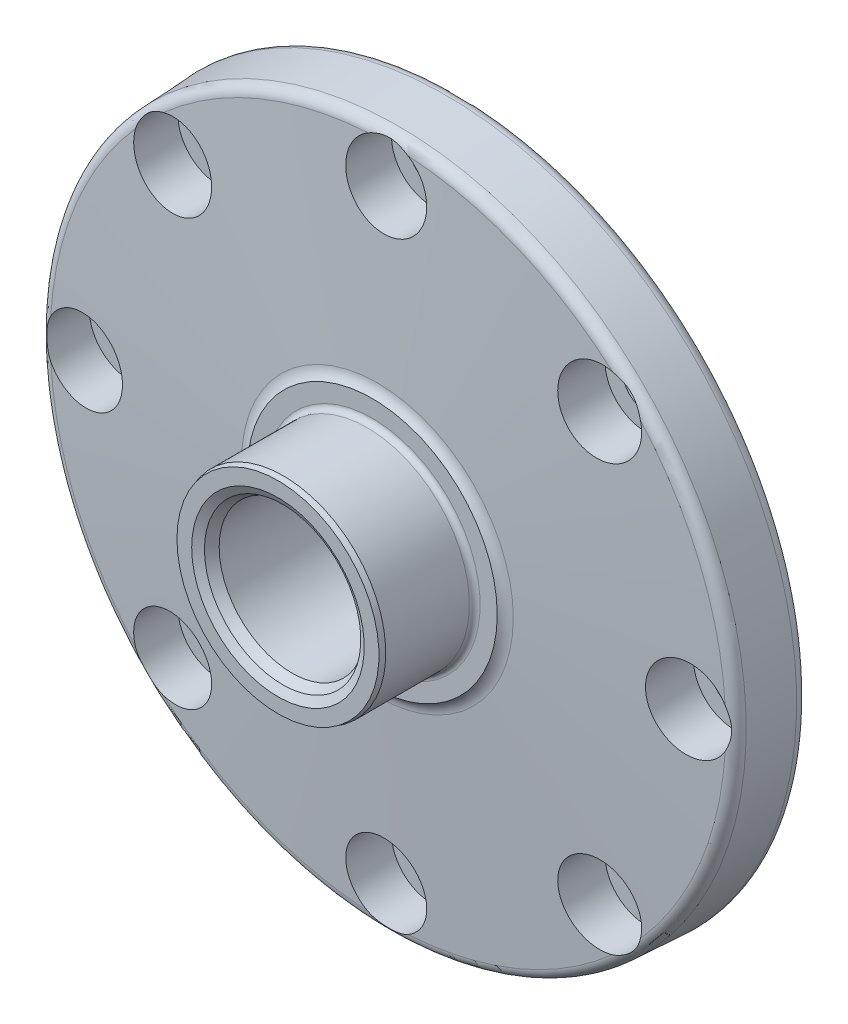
SolidWorks part; units mm, degrees
ref_plane "Plan de face" through (0, 0, 0) normal (0, 0, 1) x (1, 0, 0)
ref_plane "Plan de dessus" through (0, 0, 0) normal (0, 1, 0) x (1, 0, 0)
ref_plane "Plan de droite" through (0, 0, 0) normal (1, 0, 0) x (0, 0, -1)
sketch "Esquisse1" plane through (0, 0, 0) normal (1, 0, 0) x (0, 0, -1)
  line L0 (0, 0) -> (-55.1375, 0) construction
  line L1 (-16.0037, 64.5336) -> (-7.1047, 65)
  line L2 (0, 0) -> (0, 69.4206) construction
  line L3 (-38.1047, 21.5512) -> (-22.6975, 22.3586)
  line L4 (-2.157, 51) -> (1.1047, 50.8291)
  line L5 (-5, 53.9959) -> (-5, 63.0027)
  line L7 (-17.8963, 62.641) -> (-19.8586, 25.1975)
  line L8 (3, 35) -> (-9.157, 34.3629)
  line L11 (-40, 19.5539) -> (-40, 11)
  line L19 (3, 48.8318) -> (3, 35)
  line L23 (-12, 31.367) -> (-12, 14.3653)
  line L24 (-13.8953, 12.3681) -> (-40, 11)
  arc A0 (1.1047, 50.8291) -> (3, 48.8318) centre (1, 48.8318) cw
  arc A1 (-2.157, 51) -> (-5, 53.9959) centre (-2, 53.9959) cw
  arc A2 (-16.0037, 64.5336) -> (-17.8963, 62.641) centre (-15.899, 62.5364) ccw
  arc A3 (-12, 31.367) -> (-9.157, 34.3629) centre (-9, 31.367) cw
  arc A4 (-5, 63.0027) -> (-7.1047, 65) centre (-7, 63.0027) ccw
  arc A5 (-22.6975, 22.3586) -> (-19.8586, 25.1975) centre (-22.8545, 25.3545) ccw
  arc A6 (-12, 14.3653) -> (-13.8953, 12.3681) centre (-14, 14.3653) cw
  arc A7 (-38.1047, 21.5512) -> (-40, 19.5539) centre (-38, 19.5539) ccw
  point P23 (-20, 22.5)
  dimension "D6" = 70
  dimension "D1" = 2
  dimension "D2" = 3
  dimension "D3" = 3
  dimension "D4" = 3
  dimension "D5" = 130
  dimension "D7" = 22
  dimension "D8" = 102
  dimension "D9" = 43
  dimension "D10" = 12
  dimension "D11" = 3
  dimension "D13" = 20
  dimension "D14" = 45
  dimension "D15" = 5
revolve "Brut-Révolution-1" add sketch "Esquisse1" angle 360 about L0
sketch "Esquisse12" plane through (0, 0, 0) normal (1, 0, 0) x (0, 0, -1)
  line L0 (0, 65.0027) -> (0, 79.0399) construction
  line L1 (0, 0) -> (-48.9974, 0) construction
  line L2 (0, 42.5) -> (0, 49.4656)
  line L3 (-1.5, 65.0027) -> (-20.8, 65.0027)
  line L4 (-38.3, 0) -> (-52.3372, 0)
  line L5 (-52.3372, 0) -> (-52.3372, 79.0399)
  line L6 (-52.3372, 79.0399) -> (17.0372, 79.0399)
  line L7 (17.0372, 79.0399) -> (17.0372, 0)
  line L8 (-20.8, 65.0027) -> (-20.8, 20)
  line L9 (-21.8, 19) -> (-38.3, 19)
  line L10 (-38.3, 19) -> (-38.3, 0)
  line L11 (17.0372, 0) -> (3, 0)
  line L12 (-1.5, 65.0027) -> (-1.5, 50.9656)
  line L13 (-1.5, 50.9656) -> (0, 49.4656)
  line L14 (0, 79.0399) -> (0, 49.4656) construction
  line L15 (-1.5, 65.0027) -> (0, 65.0027) construction
  line L16 (1.1047, 50.8291) -> (-2.157, 51) construction
  line L18 (3, 0) -> (3, 42)
  line L19 (3, 42) -> (0.5, 42)
  arc A0 (-5, 63.0027) -> (-7.1047, 65) centre (-7, 63.0027) ccw construction
  arc A3 (-20.8, 20) -> (-21.8, 19) centre (-21.8, 20) cw
  arc A5 (0, 42.5) -> (0.5, 42) centre (0.5, 42.5) ccw
  dimension "D17" = 1
  dimension "D20" = 0.5
  dimension "D1" = 38.3
  dimension "D2" = 20.8
  dimension "D3" = 3
  dimension "D4" = 45
  dimension "D5" = 1.5
  dimension "D9" = 38
  dimension "D12" = 84
revolve "Chariotage" cut sketch "Esquisse12" angle 360 about L1
chamfer "Chanfrein1" distance 1 angle 15 1 edges at (-19, 0, 38.3)
chamfer "Chanfrein2" distance 1 angle 15 1 edges at (-42, 0, -3)
sketch "Esquisse13" plane through (0, 0, 0) normal (1, 0, 0) x (0, 0, -1)
  line L0 (-38.3, 0) -> (3, 0)
  line L1 (0, 0) -> (-49.0722, 0) construction
  line L2 (3, -42) -> (3, 42) construction
  line L3 (-38.3, 19) -> (-38.3, -19) construction
  line L4 (3, 0) -> (3, 37.1)
  line L5 (-38.3, 16) -> (-38.3, 0)
  line L6 (-35.7019, 13.5) -> (-14.5, 13.5)
  line L7 (-14.5, 13.5) -> (-14.5, 21)
  line L8 (-14.5, 21) -> (-13.3, 21)
  line L9 (-13.3, 21) -> (-13.3, 40.5)
  line L10 (-13.3, 40.5) -> (-12.3, 40.5)
  line L11 (-12.3, 40.5) -> (-12.3, 37.1)
  line L12 (-12.3, 37.1) -> (3, 37.1)
  line L13 (0, -49.4656) -> (0, 49.4656) construction
  line L15 (-38.3, 16) -> (-37.434, 14.5)
  line L16 (-37.434, 14.5) -> (-35.7019, 13.5)
  dimension "D2" = 14.5
  dimension "D3" = 13.3
  dimension "D4" = 12.3
  dimension "D7" = 60
  dimension "D8" = 30
  dimension "D11" = 74.2
  dimension "D12" = 42
  dimension "D13" = 81
  dimension "D14" = 27
  dimension "D17" = 32
  dimension "D18" = 29
revolve "Alésage" cut sketch "Esquisse13" angle 360 about L1
sketch "Esquisse14" plane through (0, 0, 0) normal (0, 0, 1) x (1, 0, 0)
  line L0 (-0.3281, 37.5986) -> (0, 0) construction
  line L1 (0, 0) -> (0.3281, 37.5986) construction
  line L2 (0.3281, 37.5986) -> (-0.3281, 37.5986) construction
  line L3 (0, 0) -> (0, 40.1) construction
  line L4 (0, 0) -> (7.8231, 39.3295) construction
  line L5 (0, 0) -> (15.3456, 37.0476) construction
  line L6 (0, 0) -> (22.2784, 33.3419) construction
  line L7 (0, 0) -> (28.355, 28.355) construction
  line L8 (0, 0) -> (40.1, 0) construction
  line L9 (0, 0) -> (39.3295, -7.8231) construction
  line L10 (0, 0) -> (37.0476, -15.3456) construction
  line L11 (0, 0) -> (33.3419, -22.2784) construction
  line L12 (0, 0) -> (28.355, -28.355) construction
  line L13 (0, 0) -> (0, -40.1) construction
  line L14 (0, 0) -> (-7.8231, -39.3295) construction
  line L15 (0, 0) -> (-15.3456, -37.0476) construction
  line L16 (0, 0) -> (-22.2784, -33.3419) construction
  line L17 (0, 0) -> (-28.355, -28.355) construction
  line L18 (0, 0) -> (-40.1, 0) construction
  line L19 (0, 0) -> (-39.3295, 7.8231) construction
  line L20 (0, 0) -> (-37.0476, 15.3456) construction
  line L21 (0, 0) -> (-33.3419, 22.2784) construction
  line L22 (0, 0) -> (-28.355, 28.355) construction
  arc A0 (-3.0109, 37.4793) -> (-24.3728, 28.6309) centre (0, 0) ccw
  arc A1 (0.3499, 40.0985) -> (-0.3499, 40.0985) centre (0, 0) ccw
  arc A2 (-0.3499, 40.0985) -> (-2.827, 37.6727) centre (-0.3281, 37.5986) ccw
  arc A3 (2.827, 37.6727) -> (0.3499, 40.0985) centre (0.3281, 37.5986) ccw
  arc A4 (10.1223, 36.3973) -> (8.166, 39.2597) centre (7.6569, 36.8121) ccw
  arc A5 (7.4796, 39.3963) -> (4.5769, 37.5003) centre (7.0133, 36.9401) ccw
  arc A6 (17.0285, 33.7232) -> (15.6683, 36.9122) centre (14.6915, 34.611) ccw
  arc A7 (15.0217, 37.1801) -> (11.8049, 35.8869) centre (14.0852, 34.8621) ccw
  arc A8 (23.2804, 29.7531) -> (22.5685, 33.1462) centre (21.1615, 31.0798) ccw
  arc A9 (21.9866, 33.5351) -> (18.5792, 32.8943) centre (20.6158, 31.4444) ccw
  arc A10 (28.6376, 24.6396) -> (28.6013, 28.1065) centre (26.8182, 26.3542) ccw
  arc A11 (28.1065, 28.6013) -> (24.6396, 28.6376) centre (26.3542, 26.8182) ccw
  arc A12 (8.166, 39.2597) -> (7.4796, 39.3963) centre (0, 0) ccw
  arc A13 (15.6683, 36.9122) -> (15.0217, 37.1801) centre (0, 0) ccw
  arc A14 (22.5685, 33.1462) -> (21.9866, 33.5351) centre (0, 0) ccw
  arc A15 (4.3588, 37.3465) -> (3.0109, 37.4793) centre (0, 0) ccw
  arc A16 (11.561, 35.7785) -> (10.2649, 36.1717) centre (0, 0) ccw
  arc A17 (18.3189, 32.8356) -> (17.1244, 33.4741) centre (0, 0) ccw
  arc A18 (24.3728, 28.6309) -> (23.3258, 29.4901) centre (0, 0) ccw
  arc A19 (-2.827, 37.6727) -> (-3.0109, 37.4793) centre (-3.0269, 37.6786) cw
  arc A20 (2.827, 37.6727) -> (3.0109, 37.4793) centre (3.0269, 37.6786) ccw
  arc A21 (4.5769, 37.5003) -> (4.3588, 37.3465) centre (4.382, 37.5452) cw
  arc A22 (10.1223, 36.3973) -> (10.2649, 36.1717) centre (10.3195, 36.3641) ccw
  arc A23 (11.8049, 35.8869) -> (11.561, 35.7785) centre (11.6225, 35.9689) cw
  arc A24 (17.0285, 33.7232) -> (17.1244, 33.4741) centre (17.2155, 33.6521) ccw
  arc A25 (18.5792, 32.8943) -> (18.3189, 32.8356) centre (18.4163, 33.0103) cw
  arc A26 (23.2804, 29.7531) -> (23.3258, 29.4901) centre (23.4499, 29.6469) ccw
  arc A27 (24.6396, 28.6376) -> (24.3728, 28.6309) centre (24.5024, 28.7832) cw
  arc A28 (28.6376, 24.6396) -> (28.6309, 24.3728) centre (28.7832, 24.5024) ccw
  arc A29 (40.0985, -0.3499) -> (40.0985, 0.3499) centre (0, 0) ccw
  arc A30 (40.0985, 0.3499) -> (37.6727, 2.827) centre (37.5986, 0.3281) ccw
  arc A31 (37.6727, -2.827) -> (40.0985, -0.3499) centre (37.5986, -0.3281) ccw
  arc A32 (36.3973, -10.1223) -> (39.2597, -8.166) centre (36.8121, -7.6569) ccw
  arc A33 (39.3963, -7.4796) -> (37.5003, -4.5769) centre (36.9401, -7.0133) ccw
  arc A34 (33.7232, -17.0285) -> (36.9122, -15.6683) centre (34.611, -14.6915) ccw
  arc A35 (37.1801, -15.0217) -> (35.8869, -11.8049) centre (34.8621, -14.0852) ccw
  arc A36 (29.7531, -23.2804) -> (33.1462, -22.5685) centre (31.0798, -21.1615) ccw
  arc A37 (33.5351, -21.9866) -> (32.8943, -18.5792) centre (31.4444, -20.6158) ccw
  arc A38 (24.6396, -28.6376) -> (28.1065, -28.6013) centre (26.3542, -26.8182) ccw
  arc A39 (28.6013, -28.1065) -> (28.6376, -24.6396) centre (26.8182, -26.3542) ccw
  arc A40 (39.2597, -8.166) -> (39.3963, -7.4796) centre (0, 0) ccw
  arc A41 (36.9122, -15.6683) -> (37.1801, -15.0217) centre (0, 0) ccw
  arc A42 (33.1462, -22.5685) -> (33.5351, -21.9866) centre (0, 0) ccw
  arc A43 (37.3465, -4.3588) -> (37.4793, -3.0109) centre (0, 0) ccw
  arc A44 (35.7785, -11.561) -> (36.1717, -10.2649) centre (0, 0) ccw
  arc A45 (32.8356, -18.3189) -> (33.4741, -17.1244) centre (0, 0) ccw
  arc A46 (28.6309, -24.3728) -> (29.4901, -23.3258) centre (0, 0) ccw
  arc A47 (37.6727, -2.827) -> (37.4793, -3.0109) centre (37.6786, -3.0269) ccw
  arc A48 (37.5003, -4.5769) -> (37.3465, -4.3588) centre (37.5452, -4.382) cw
  arc A49 (36.3973, -10.1223) -> (36.1717, -10.2649) centre (36.3641, -10.3195) ccw
  arc A50 (35.8869, -11.8049) -> (35.7785, -11.561) centre (35.9689, -11.6225) cw
  arc A51 (33.7232, -17.0285) -> (33.4741, -17.1244) centre (33.6521, -17.2155) ccw
  arc A52 (32.8943, -18.5792) -> (32.8356, -18.3189) centre (33.0103, -18.4163) cw
  arc A53 (29.7531, -23.2804) -> (29.4901, -23.3258) centre (29.6469, -23.4499) ccw
  arc A54 (28.6376, -24.6396) -> (28.6309, -24.3728) centre (28.7832, -24.5024) cw
  arc A55 (24.6396, -28.6376) -> (24.3728, -28.6309) centre (24.5024, -28.7832) ccw
  arc A56 (28.1065, -28.6013) -> (28.6013, -28.1065) centre (0, 0) ccw
  arc A57 (-0.3499, -40.0985) -> (0.3499, -40.0985) centre (0, 0) ccw
  arc A58 (0.3499, -40.0985) -> (2.827, -37.6727) centre (0.3281, -37.5986) ccw
  arc A59 (-2.827, -37.6727) -> (-0.3499, -40.0985) centre (-0.3281, -37.5986) ccw
  arc A60 (-10.1223, -36.3973) -> (-8.166, -39.2597) centre (-7.6569, -36.8121) ccw
  arc A61 (-7.4796, -39.3963) -> (-4.5769, -37.5003) centre (-7.0133, -36.9401) ccw
  arc A62 (-17.0285, -33.7232) -> (-15.6683, -36.9122) centre (-14.6915, -34.611) ccw
  arc A63 (-15.0217, -37.1801) -> (-11.8049, -35.8869) centre (-14.0852, -34.8621) ccw
  arc A64 (-23.2804, -29.7531) -> (-22.5685, -33.1462) centre (-21.1615, -31.0798) ccw
  arc A65 (-21.9866, -33.5351) -> (-18.5792, -32.8943) centre (-20.6158, -31.4444) ccw
  arc A66 (-28.6376, -24.6396) -> (-28.6013, -28.1065) centre (-26.8182, -26.3542) ccw
  arc A67 (-28.1065, -28.6013) -> (-24.6396, -28.6376) centre (-26.3542, -26.8182) ccw
  arc A68 (-8.166, -39.2597) -> (-7.4796, -39.3963) centre (0, 0) ccw
  arc A69 (-15.6683, -36.9122) -> (-15.0217, -37.1801) centre (0, 0) ccw
  arc A70 (-22.5685, -33.1462) -> (-21.9866, -33.5351) centre (0, 0) ccw
  arc A71 (-4.3588, -37.3465) -> (-3.0109, -37.4793) centre (0, 0) ccw
  arc A72 (-11.561, -35.7785) -> (-10.2649, -36.1717) centre (0, 0) ccw
  arc A73 (-18.3189, -32.8356) -> (-17.1244, -33.4741) centre (0, 0) ccw
  arc A74 (28.6013, 28.1065) -> (28.1065, 28.6013) centre (0, 0) ccw
  arc A75 (-24.3728, -28.6309) -> (-23.3258, -29.4901) centre (0, 0) ccw
  arc A76 (-2.827, -37.6727) -> (-3.0109, -37.4793) centre (-3.0269, -37.6786) ccw
  arc A77 (-4.5769, -37.5003) -> (-4.3588, -37.3465) centre (-4.382, -37.5452) cw
  arc A78 (-10.1223, -36.3973) -> (-10.2649, -36.1717) centre (-10.3195, -36.3641) ccw
  arc A79 (-11.8049, -35.8869) -> (-11.561, -35.7785) centre (-11.6225, -35.9689) cw
  arc A80 (-17.0285, -33.7232) -> (-17.1244, -33.4741) centre (-17.2155, -33.6521) ccw
  arc A81 (-18.5792, -32.8943) -> (-18.3189, -32.8356) centre (-18.4163, -33.0103) cw
  arc A82 (-23.2804, -29.7531) -> (-23.3258, -29.4901) centre (-23.4499, -29.6469) ccw
  arc A83 (-24.6396, -28.6376) -> (-24.3728, -28.6309) centre (-24.5024, -28.7832) cw
  arc A84 (-28.6376, -24.6396) -> (-28.6309, -24.3728) centre (-28.7832, -24.5024) ccw
  arc A85 (-28.6013, -28.1065) -> (-28.1065, -28.6013) centre (0, 0) ccw
  arc A86 (-40.0985, 0.3499) -> (-40.0985, -0.3499) centre (0, 0) ccw
  arc A87 (-40.0985, -0.3499) -> (-37.6727, -2.827) centre (-37.5986, -0.3281) ccw
  arc A88 (-37.6727, 2.827) -> (-40.0985, 0.3499) centre (-37.5986, 0.3281) ccw
  arc A89 (-36.3973, 10.1223) -> (-39.2597, 8.166) centre (-36.8121, 7.6569) ccw
  arc A90 (-39.3963, 7.4796) -> (-37.5003, 4.5769) centre (-36.9401, 7.0133) ccw
  arc A91 (-33.7232, 17.0285) -> (-36.9122, 15.6683) centre (-34.611, 14.6915) ccw
  arc A92 (-37.1801, 15.0217) -> (-35.8869, 11.8049) centre (-34.8621, 14.0852) ccw
  arc A93 (-29.7531, 23.2804) -> (-33.1462, 22.5685) centre (-31.0798, 21.1615) ccw
  arc A94 (-33.5351, 21.9866) -> (-32.8943, 18.5792) centre (-31.4444, 20.6158) ccw
  arc A95 (-24.6396, 28.6376) -> (-28.1065, 28.6013) centre (-26.3542, 26.8182) ccw
  arc A96 (-28.6013, 28.1065) -> (-28.6376, 24.6396) centre (-26.8182, 26.3542) ccw
  arc A97 (-39.2597, 8.166) -> (-39.3963, 7.4796) centre (0, 0) ccw
  arc A98 (-36.9122, 15.6683) -> (-37.1801, 15.0217) centre (0, 0) ccw
  arc A99 (-33.1462, 22.5685) -> (-33.5351, 21.9866) centre (0, 0) ccw
  arc A100 (-37.3465, 4.3588) -> (-37.4793, 3.0109) centre (0, 0) ccw
  arc A101 (-35.7785, 11.561) -> (-36.1717, 10.2649) centre (0, 0) ccw
  arc A102 (-32.8356, 18.3189) -> (-33.4741, 17.1244) centre (0, 0) ccw
  arc A103 (-28.6309, 24.3728) -> (-29.4901, 23.3258) centre (0, 0) ccw
  arc A104 (-37.6727, 2.827) -> (-37.4793, 3.0109) centre (-37.6786, 3.0269) ccw
  arc A105 (-37.5003, 4.5769) -> (-37.3465, 4.3588) centre (-37.5452, 4.382) cw
  arc A106 (-36.3973, 10.1223) -> (-36.1717, 10.2649) centre (-36.3641, 10.3195) ccw
  arc A107 (-35.8869, 11.8049) -> (-35.7785, 11.561) centre (-35.9689, 11.6225) cw
  arc A108 (-33.7232, 17.0285) -> (-33.4741, 17.1244) centre (-33.6521, 17.2155) ccw
  arc A109 (-32.8943, 18.5792) -> (-32.8356, 18.3189) centre (-33.0103, 18.4163) cw
  arc A110 (-29.7531, 23.2804) -> (-29.4901, 23.3258) centre (-29.6469, 23.4499) ccw
  arc A111 (-28.6376, 24.6396) -> (-28.6309, 24.3728) centre (-28.7832, 24.5024) cw
  arc A112 (-24.6396, 28.6376) -> (-24.3728, 28.6309) centre (-24.5024, 28.7832) ccw
  arc A113 (-28.1065, 28.6013) -> (-28.6013, 28.1065) centre (0, 0) ccw
  arc A114 (28.6309, 24.3728) -> (37.4793, 3.0109) centre (0, 0) cw
  arc A115 (24.3728, -28.6309) -> (3.0109, -37.4793) centre (0, 0) cw
  arc A116 (-28.6309, -24.3728) -> (-37.4793, -3.0109) centre (0, 0) cw
  arc A117 (-37.4793, -3.0109) -> (-37.6727, -2.827) centre (-37.6786, -3.0269) ccw
  arc A118 (2.827, -37.6727) -> (3.0109, -37.4793) centre (3.0269, -37.6786) cw
  arc A119 (37.6727, 2.827) -> (37.4793, 3.0109) centre (37.6786, 3.0269) cw
  point P8 (0, 37.5986)
  point P48 (4.543, 37.3245)
  point P72 (37.5986, 0)
  point P131 (0, -37.5986)
  point P192 (-37.5986, 0)
  dimension "D2" = 40.1
  dimension "D3" = 37.6
  dimension "D4" = 2.5
  dimension "D6" = 0.2
  dimension "D7" = 4
  dimension "D1" = 1
  dimension "D5" = 11.25
extrude "Enlèv. mat.-Extru.1" cut sketch "Esquisse14" along normal up to surface (13.3 mm away) and the other way through all
hole_wizard "Chambrage pour vis à tête hexagonale M84" positions "Esquisse10" profile "Esquisse9" counterbore size "M8" standard "ISO"
sketch "Esquisse10" plane through (4.4594, 43.1209, 20.8) normal (0, 0, 1) x (1, 0, 0)
  circle A0 centre (-4.4594, -43.1209) radius 56 construction
  point P0 (-4.4594, -99.1209)
  point P25 (-44.0573, -82.7189)
  point P26 (-60.4594, -43.1209)
  point P27 (-44.0573, -3.5229)
  point P28 (-4.4594, 12.8791)
  point P29 (35.1386, -3.5229)
  point P30 (51.5406, -43.1209)
  point P31 (35.1386, -82.7189)
  dimension "D1" = 112
sketch "Esquisse9" plane through (0, -56, 20.8) normal (1, 0, 0) x (0, -1, 0)
  line L0 (0, 0) -> (0, 23.8)
  line L1 (0, 23.8) -> (4.2, 23.8)
  line L3 (4.2, 23.8) -> (4.2, 11.05)
  line L4 (4.2, 11.05) -> (7.5, 11.05)
  line L5 (7.5, 11.05) -> (7.5, 0)
  line L6 (0.232, 20.8) -> (-112.232, 20.8) construction
  line L7 (7.5, 0) -> (0, 0)
  line L11 (0, -6.35) -> (0, 107.95) construction
  dimension "Diamètre du perçage jusqu'au prochain" = 8.4
  dimension "Profondeur du perçage jusqu'au prochain" = 23.8
  dimension "Diamètre du chambrage" = 15
